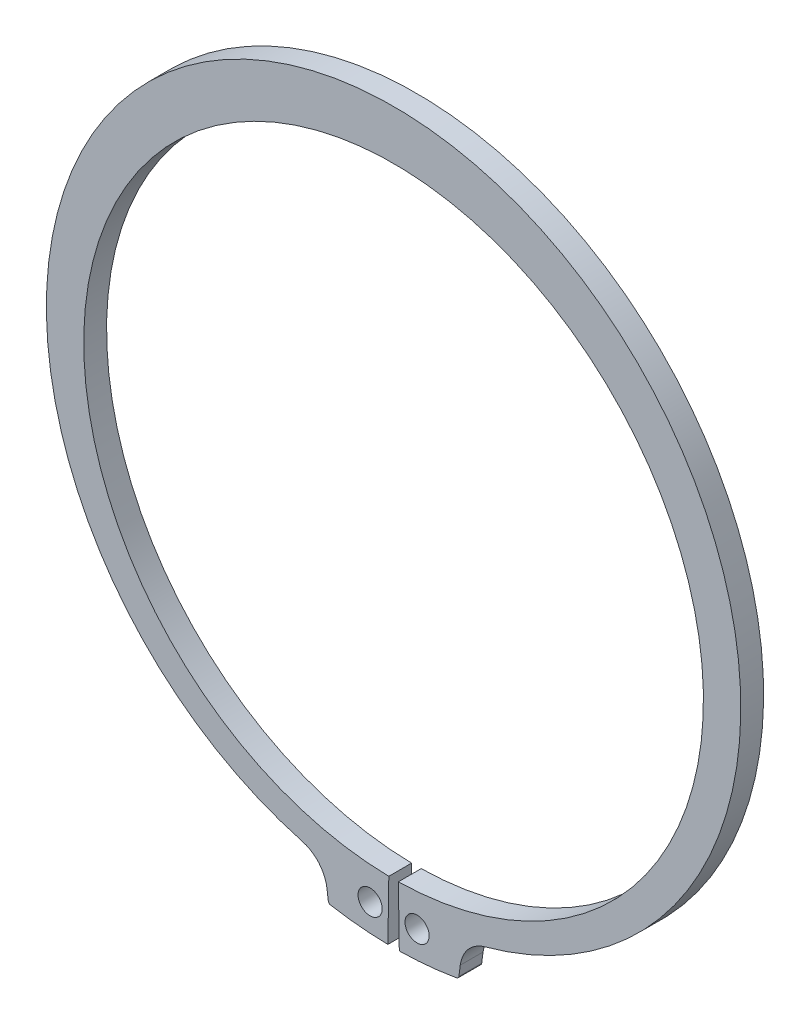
SolidWorks part; units mm, degrees
ref_plane "Plane1" through (0, 0, 0) normal (0, 0, 1) x (1, 0, 0)
ref_plane "Plane2" through (0, 0, 0) normal (0, 1, 0) x (1, 0, 0)
ref_plane "Plane3" through (0, 0, 0) normal (1, 0, 0) x (0, 0, -1)
extrude "Body" add sketch "BodySke" against normal blind 3
sketch "BodySke" plane through (0, 0, 0) normal (0, 0, 1) x (1, 0, 0)
  line L0 (-1.5431, 0) -> (1.5431, 0) construction
  line L1 (0, 0) -> (0, 47.2524) construction
  line L2 (0.6292, -40.7451) -> (0.75, -48.5674)
  line L3 (-0.6292, -40.7451) -> (-0.75, -48.5674)
  line L4 (0, 0) -> (13.174, -46.7526) construction
  line L5 (0, 0) -> (-13.174, -46.7526) construction
  line L7 (8.7672, -46.1724) -> (8.5875, -47.5375)
  line L8 (-8.7672, -46.1724) -> (-8.5875, -47.5375)
  circle A0 centre (0, 0) radius 40.75 construction
  arc A1 (0.6292, -40.7451) -> (-0.6292, -40.7451) centre (0, 0) ccw
  arc A2 (11.9684, -42.4742) -> (-11.9684, -42.4742) centre (0, 1.5909) ccw construction
  arc A3 (0.75, -48.5674) -> (8.2747, -47.8632) centre (0, 0) ccw
  arc A4 (12.0054, -42.4641) -> (8.7672, -46.1724) centre (13.174, -46.7526) ccw
  arc A5 (-8.7672, -46.1724) -> (-12.0054, -42.4641) centre (-13.174, -46.7526) ccw
  arc A6 (-8.2747, -47.8632) -> (-0.75, -48.5674) centre (0, 0) ccw
  arc A7 (12.0054, -42.4641) -> (-12.0054, -42.4641) centre (0, 1.5909) ccw
  arc A8 (-9.0424, -44.0821) -> (9.0424, -44.0821) centre (0, 0) ccw construction
  circle A9 centre (3.0875, -44.894) radius 1.5875
  circle A10 centre (-3.0875, -44.894) radius 1.5875
  arc A11 (8.5875, -47.5375) -> (8.2747, -47.8632) centre (8.2098, -47.4878) cw
  arc A12 (-8.5875, -47.5375) -> (-8.2747, -47.8632) centre (-8.2098, -47.4878) ccw
  point P28 (8.551, -47.8146)
  point P31 (-8.551, -47.8146)
  dimension "GrooveDia" = 81.5
  dimension "D3" = 0.381
  dimension "LugRad" = 48.5732
  dimension "HoleOffsetRad" = 45
  dimension "HoleDia" = 3.175
  dimension "D2" = 15
  dimension "LargeRad" = 47.2524
  dimension "SmallRad" = 44.1282
  dimension "Gap" = 1.5
  dimension "SmallAngle" = 31.474
  dimension "HoleSpacing" = 6.175
sketch "Clipboard" plane through (0, 0, 0) normal (0, 0, 1) x (1, 0, 0)
  line L0 (0, 0) -> (6.5024, 0)
  line L1 (0, 0) -> (0, 3.3782)
  line L2 (0, 0) -> (0, -7.8232)
  circle A0 centre (0, 0) radius 1.5875
  circle A1 centre (0, 0) radius 36.5125
  dimension "HoleDia" = 3.175
  dimension "ShaftDia" = 73.025
  dimension "LargeSection" = 6.5024
  dimension "SmallSection" = 3.3782
  dimension "LugSection" = 7.8232
sketch "NotSke" plane through (0, 0, 0) normal (0, 0, 1) x (1, 0, 0)
  line L0 (3.0875, -43.3065) -> (3.0875, -46.4815)
  line L1 (3.0875, -46.4815) -> (-3.0875, -46.4815)
  line L2 (-3.0875, -46.4815) -> (-3.0875, -43.3065)
  line L3 (-3.0875, -43.3065) -> (3.0875, -43.3065)
  circle A0 centre (3.0875, -44.894) radius 1.5875 construction
  circle A1 centre (-3.0875, -44.894) radius 1.5875 construction
extrude "Notch" [suppressed] cut sketch "NotSke" against normal through all
sketch "Esquisse1" plane through (0, 0, 0) normal (0, 0, 1) x (1, 0, 0)
  line L1 (0, 50.6546) -> (-49.3688, 50.6546)
  line L2 (0, 50.6546) -> (0, -55.4825)
  line L3 (0, -55.4825) -> (-49.3688, -55.4825)
  line L4 (-49.3688, 50.6546) -> (-49.3688, -55.4825)
extrude "Coupe" [suppressed] cut sketch "Esquisse1" against normal through all
equation "' \"ShaftDia@Clipboard\" = 0.125"
equation "' \"Thickness@Body\" = 0.01"
equation "' \"GrooveDia@BodySke\" = 0.117"
equation "' \"LugSection@Clipboard\" = 0.046"
equation "' \"LargeSection@Clipboard\" = 0.018"
equation "' \"SmallSection@Clipboard\" = 0.011"
equation "' \"HoleDia@Clipboard\" = 0.026"
equation "' \"ShaftDia@Clipboard\" = 0.394"
equation "' \"Thickness@Body\" = 0.025"
equation "' \"GrooveDia@BodySke\" = 0.369"
equation "' \"LugSection@Clipboard\" = 0.087"
equation "' \"LargeSection@Clipboard\" = 0.052"
equation "' \"SmallSection@Clipboard\" = 0.031"
equation "' \"HoleDia@Clipboard\" = 0.041"
equation "\"Gap@BodySke\" =  \"Thickness@Body\" / 2"
equation "\"LargeRad@BodySke\" =  \"GrooveDia@BodySke\" / 2 +  \"LargeSection@Clipboard\""
equation "\"SmallRad@BodySke\" =  \"GrooveDia@BodySke\" / 2 +  \"SmallSection@Clipboard\""
equation "\"LugRad@BodySke\" = \"GrooveDia@BodySke\" / 2 + \"LugSection@Clipboard\""
equation "\"HoleOffsetRad@BodySke\" = (  \"ShaftDia@Clipboard\" / 2 + \"LugRad@BodySke\" ) / 2"
equation "\"HoleSpacing@BodySke\" = \"Gap@BodySke\"  * 2 +  \"HoleDia@Clipboard\""
equation "\"HoleDia@BodySke\" =  \"HoleDia@Clipboard\""
equation "\"SmallAngle@BodySke\" = atn(\"HoleSpacing@BodySke\" / 2 / sqr(\"HoleOffsetRad@BodySke\"  * \"HoleOffsetRad@BodySke\" - (\"HoleSpacing@BodySke\" / 2) * (\"HoleSpacing@BodySke\" / 2) ))  * 8 * ( 180 / 3.141593)"
